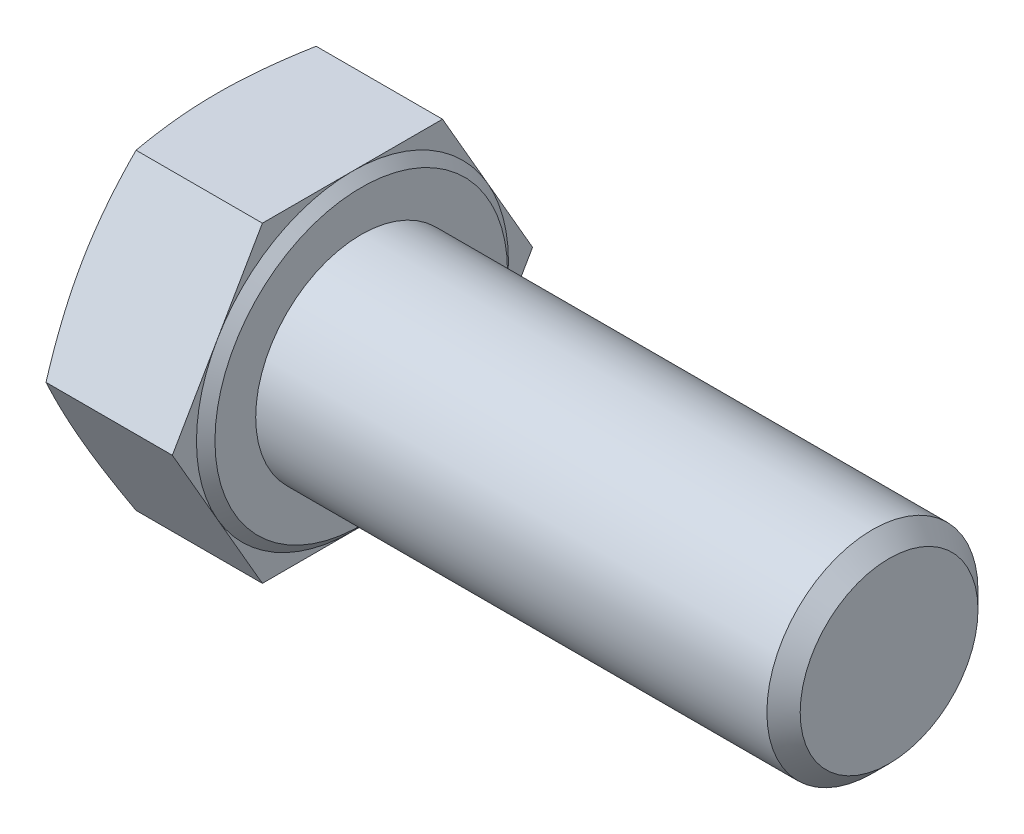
SolidWorks part; units mm, degrees
ref_plane "Front" through (0, 0, 0) normal (0, 0, 1) x (1, 0, 0)
ref_plane "Top" through (0, 0, 0) normal (0, 1, 0) x (1, 0, 0)
ref_plane "Right" through (0, 0, 0) normal (1, 0, 0) x (0, 0, -1)
other "Configuration Table"
sketch "Sketch-BaseHead" plane through (0, 0, 0) normal (1, 0, 0) x (0, 0, -1)
  line L1 (10.2364, 0) -> (5.1182, 8.865)
  line L2 (5.1182, 8.865) -> (-5.1182, 8.865)
  line L3 (-5.1182, 8.865) -> (-10.2364, 0)
  line L4 (-10.2364, 0) -> (-5.1182, -8.865)
  line L5 (-5.1182, -8.865) -> (5.1182, -8.865)
  line L6 (5.1182, -8.865) -> (10.2364, 0)
  circle A0 centre (0, 0) radius 8.865 construction
extrude "BaseHead" add sketch "Sketch-BaseHead" along normal blind 7.68
sketch "Sketch4" plane through (-0.2646, 0, 5.9169) normal (0, 1, 0) x (0, 0, -1)
  line L0 (5.9169, 3.7369) -> (5.9169, -10.4477) construction
  line L2 (16.1533, -0.2646) -> (14.7819, -0.2646)
  line L4 (14.7819, -0.2646) -> (16.1533, -0.7638)
  line L6 (16.1533, -0.7638) -> (16.1533, -0.2646)
revolve "HeadChamfer" cut sketch "Sketch4" angle 360 about L0
sketch "Sketch1" plane through (0, 0, 0) normal (0, 0, 1) x (1, 0, 0)
  line L0 (7.68, 0) -> (8.18, 0)
  line L1 (8.18, 0) -> (8.18, -8.315)
  line L2 (8.18, -8.315) -> (7.68, -8.865)
  line L3 (7.68, -8.865) -> (7.68, 0) construction
  line L4 (0, 0) -> (7.5821, 0) construction
  line L5 (-4.0016, 0) -> (10.1831, 0) construction
  line L6 (7.68, -8.865) -> (0.4992, -8.865) construction
  line L7 (7.68, 0) -> (7.68, -8.865)
revolve "Revolve1" add sketch "Sketch1" angle 360 about axis through (-4.0016, 0, 0) along (1, 0, 0)
ref_plane "Plane2" through (28.18, 0, 0) normal (1, 0, 0) x (0, 0, -1)
sketch "Sketch3" plane through (8.18, 0, 0) normal (1, 0, 0) x (0, 0, -1)
  circle A0 centre (0, 0) radius 6
extrude "BaseBody" add sketch "Sketch3" along normal blind 30
fillet "HeadFillet" [suppressed] radius 0.6
chamfer "Chamfer1" distance 0.947 angle 45 1 edges at (38.18, 0, -6)
sketch "Sketch5" plane through (0, 0, 0) normal (0, 0, 1) x (1, 0, 0)
  line L0 (36.286, 6.947) -> (37.233, 6.947)
  line L1 (37.233, 6.947) -> (37.233, 6)
  line L2 (37.233, 6) -> (36.7595, 5.1799)
  line L3 (36.7595, 5.1799) -> (36.286, 6)
  line L4 (36.286, 6) -> (36.286, 6.947)
  line L5 (37.233, -6) -> (37.233, 6) construction
  line L6 (37.233, 6) -> (8.18, 6) construction
revolve "Cut-Revolve10" [suppressed] cut sketch "Sketch5" angle 360
pattern_linear "LPattern10" [suppressed] count 9
equation "\"D1@Sketch1\" = \"s@Sketch-BaseHead\"/ 2"
equation "\"D2@Sketch4\" = \"s@Sketch-BaseHead\""
equation "\"D1@Chamfer1\" =  ( \"d@Sketch3\" - \"D2@ThreadCosmetic1\" ) / 2 "
equation "\"b@ThreadCosmetic1\" = \"l@BaseBody\" - \"lg@Plane2\""
equation "\"D1@Sketch5\" =  (\"d@Sketch3\" - \"D2@ThreadCosmetic1\" )  / 2 "
equation "\"pitch@LPattern10\" = 1.2 * \"D1@Sketch5\""
equation "\"D1@LPattern10\" = \"b@ThreadCosmetic1\" / \"pitch@LPattern10\""
